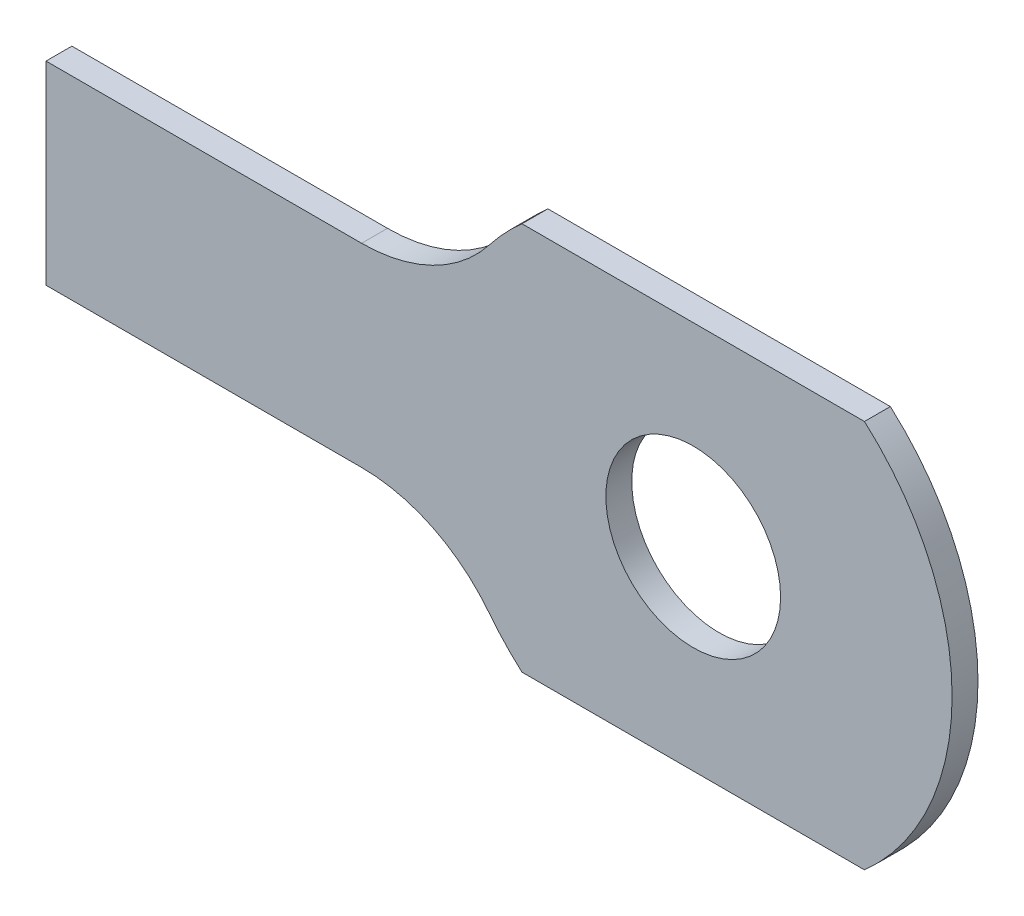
SolidWorks part; units mm, degrees
ref_plane "Front" through (0, 0, 0) normal (0, 0, 1) x (1, 0, 0)
ref_plane "Top" through (0, 0, 0) normal (0, 1, 0) x (1, 0, 0)
ref_plane "Right" through (0, 0, 0) normal (1, 0, 0) x (0, 0, -1)
sketch "Sketch1" plane through (0, 0, 0) normal (0, 0, 1) x (1, 0, 0)
  line L0 (-2.6458, 3) -> (2.6458, 3)
  line L1 (-2.6458, -3) -> (2.6458, -3)
  line L2 (-10, 1.5) -> (-5.1235, 1.5)
  line L3 (-10, -1.5) -> (-5.1235, -1.5)
  line L4 (-5.8264, 0) -> (6.0158, 0) construction
  line L5 (-10, 1.5) -> (-10, -1.5)
  arc A0 (-2.6458, 3) -> (-3.1529, 2.4615) centre (0, 0) ccw
  circle A1 centre (0, 0) radius 1.35
  arc A2 (2.6458, -3) -> (2.6458, 3) centre (0, 0) ccw
  arc A3 (-5.1235, 1.5) -> (-3.1529, 2.4615) centre (-5.1235, 4) ccw
  arc A4 (-3.1529, -2.4615) -> (-2.6458, -3) centre (0, 0) ccw
  arc A5 (-5.1235, -1.5) -> (-3.1529, -2.4615) centre (-5.1235, -4) cw
  dimension "d" = 2.7
  dimension "D2" = 3
  dimension "D0" = 8
  dimension "r" = 2.5
  dimension "B1" = 6
  dimension "B" = 3
  dimension "L" = 10
extrude "Base-Extrude" add sketch "Sketch1" against normal blind 0.4
equation "\"D2@Sketch1\" = \"B1@Sketch1\" / 2"
